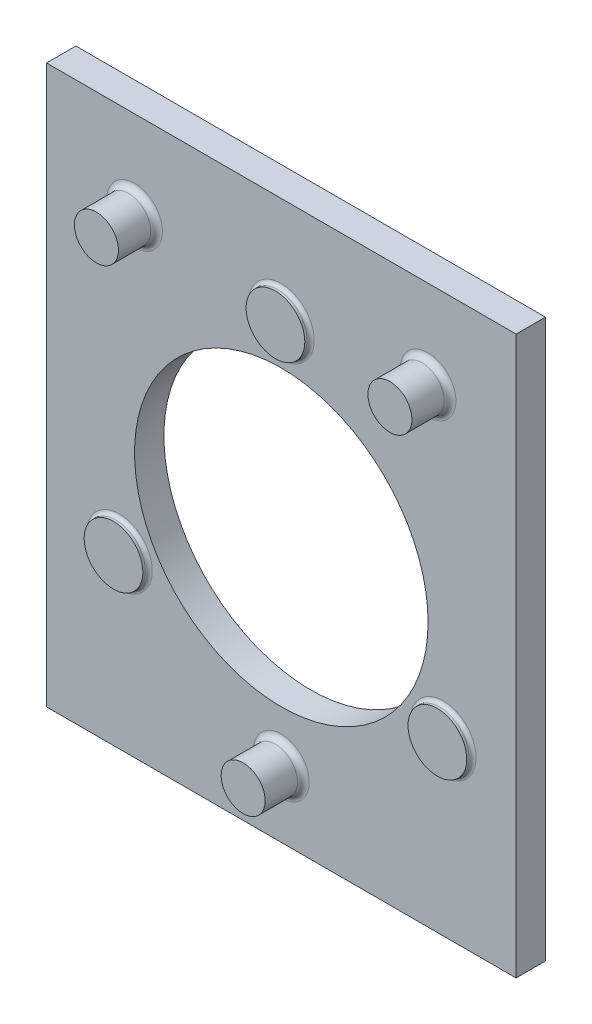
SolidWorks part; units mm, degrees
ref_plane "Front" through (0, 0, 0) normal (0, 0, 1) x (1, 0, 0)
ref_plane "Top" through (0, 0, 0) normal (0, 1, 0) x (1, 0, 0)
ref_plane "Right" through (0, 0, 0) normal (1, 0, 0) x (0, 0, -1)
sketch "Sketch1" plane through (0, 0, 0) normal (0, 0, 1) x (1, 0, 0)
  line L1 (0, 0) -> (203.2, 0)
  line L2 (0, 0) -> (0, 241.3)
  line L3 (0, 241.3) -> (203.2, 241.3)
  line L4 (203.2, 0) -> (203.2, 241.3)
  circle A0 centre (101.6, 114.3) radius 63.5
  dimension "D3" = 127
  dimension "D1" = 203.2
  dimension "D2" = 241.3
  dimension "D4" = 101.6
  dimension "D5" = 114.3
extrude "Base-Extrude" add sketch "Sketch1" along normal blind 12.7
sketch "Sketch3" plane through (0, 0, 12.7) normal (0, 0, 1) x (1, 0, 0)
  line L0 (101.6, 114.3) -> (101.6, 195.2128) construction
  line L1 (101.6, 114.3) -> (171.6725, 73.8436) construction
  line L2 (101.6, 114.3) -> (31.5275, 73.8436) construction
  circle A0 centre (31.5275, 73.8436) radius 12.7
  circle A1 centre (101.6, 195.2128) radius 12.7
  circle A2 centre (171.6725, 73.8436) radius 12.7
  circle A3 centre (101.6, 114.3) radius 63.5 construction
  circle A4 centre (101.6, 114.3) radius 63.5 construction
  circle A5 centre (101.6, 114.3) radius 80.9128 construction
  point P10 (0, 0)
  dimension "D1" = 25.4
  dimension "D2" = 25.4
  dimension "D3" = 25.4
  dimension "D4" = 161.8256
  dimension "D5" = 120
  dimension "D6" = 120
extrude "Boss-Extrude2" add sketch "Sketch3" along normal blind 2.54
sketch "Sketch4" plane through (0, 0, 12.7) normal (0, 0, 1) x (1, 0, 0)
  line L0 (203.2, 0) -> (203.2, 241.3) construction
  line L1 (203.2, 241.3) -> (0, 241.3) construction
  line L2 (0, 241.3) -> (0, 0) construction
  circle A0 centre (38.1, 203.2) radius 9.525
  circle A1 centre (165.1, 203.2) radius 9.525
  dimension "D1" = 19.05
  dimension "D4" = 19.05
  dimension "D2" = 38.1
  dimension "D3" = 38.1
  dimension "D5" = 38.1
  dimension "D6" = 38.1
extrude "Boss-Extrude4" add sketch "Sketch4" along normal blind 16.51
sketch "Sketch5" plane through (0, 0, 12.7) normal (0, 0, 1) x (1, 0, 0)
  line L0 (101.6, 0) -> (101.6, 52.9028) construction
  line L1 (0, 0) -> (203.2, 0) construction
  circle A1 centre (101.6, 28.575) radius 9.525
  dimension "D1" = 28.575
  dimension "D3" = 19.05
extrude "Boss-Extrude5" add sketch "Sketch5" along normal blind 16.51
fillet "Fillet4" radius 2.54 3 edges at (28.575, 203.2, 12.7) (155.575, 203.2, 12.7) (92.075, 28.575, 12.7)
fillet "Fillet5" radius 1.524 3 edges at (18.8275, 73.8436, 12.7) (88.9, 195.2128, 12.7) (158.9725, 73.8436, 12.7)
